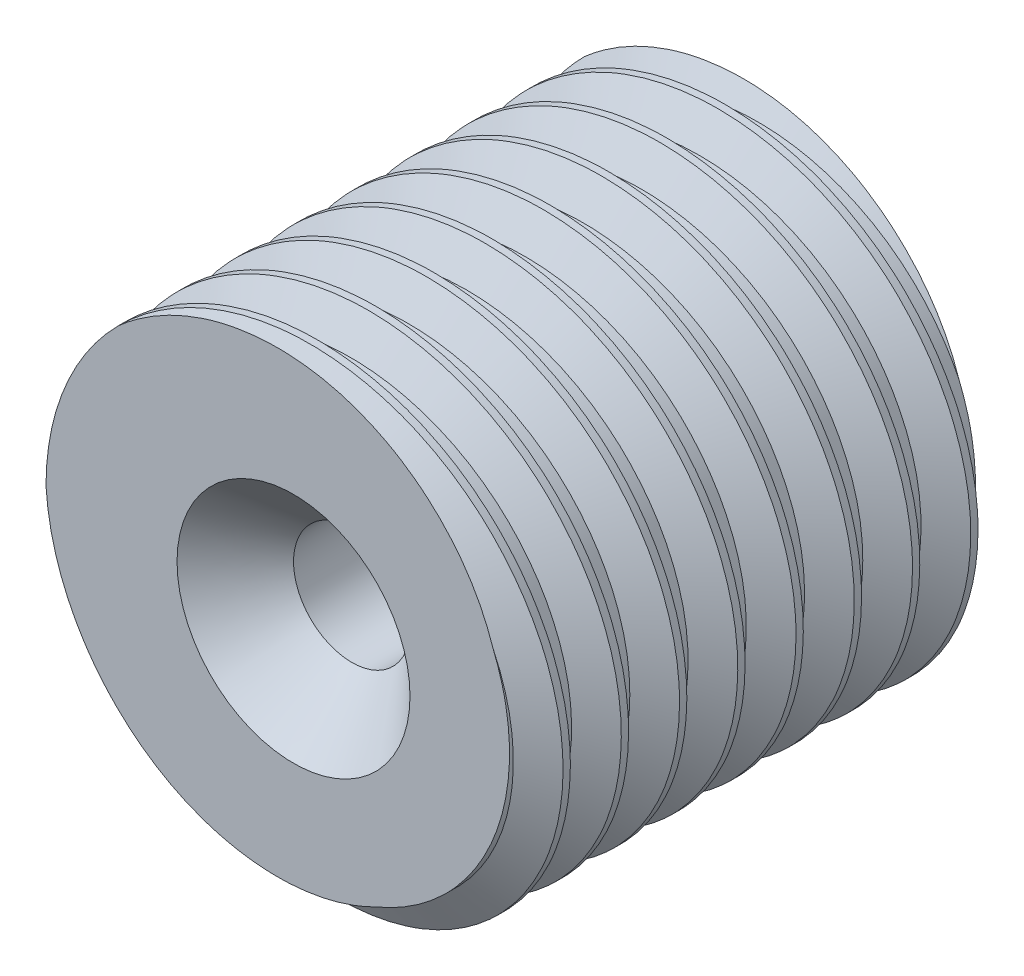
SolidWorks part; units mm, degrees
ref_plane "Front Plane" through (0, 0, 0) normal (0, 0, 1) x (1, 0, 0)
ref_plane "Top Plane" through (0, 0, 0) normal (0, 1, 0) x (1, 0, 0)
ref_plane "Right Plane" through (0, 0, 0) normal (1, 0, 0) x (0, 0, -1)
sketch "Sketch1" plane through (0, 0, 0) normal (0, 0, 1) x (1, 0, 0)
  circle A0 centre (0, 0) radius 4.25
  circle A1 centre (0, 0) radius 1
  dimension "D1" = 8.5
  dimension "D2" = 2
extrude "Boss-Extrude1" add sketch "Sketch1" along normal blind 8
thread "Thread1" pitch 1 start angle 0, offset 1, length 0, pitch 1, diameter 8.5
ref_plane "Plane1" through (-4.25, 0, 9) normal (0, -1, 0) x (-1, 0, 0)
sketch "Thread Profile1" plane through (-4.25, 0, 9) normal (0, -1, 0) x (-1, 0, 0)
  line L0 (0, 0) -> (0, 1) construction
  line L11 (0, 0) -> (0, 0.875)
  line L12 (0, 0.875) -> (-0.5413, 0.5625)
  line L13 (-0.5413, 0.5625) -> (-0.5413, 0.3125)
  line L15 (-0.5413, 0.3125) -> (0, 0)
  line L17 (-0.5413, 0.4375) -> (0, 0.4375) construction
  point P2 (0, 0)
  dimension "Pitch" = 1
  dimension "Profile_Angle" = 60
  dimension "Profile_Land" = 0.25
  dimension "Profile_Height" = 0.5413
chamfer "Chamfer1" distance 1 angle 45 1 edges at (1, 0, 8)
